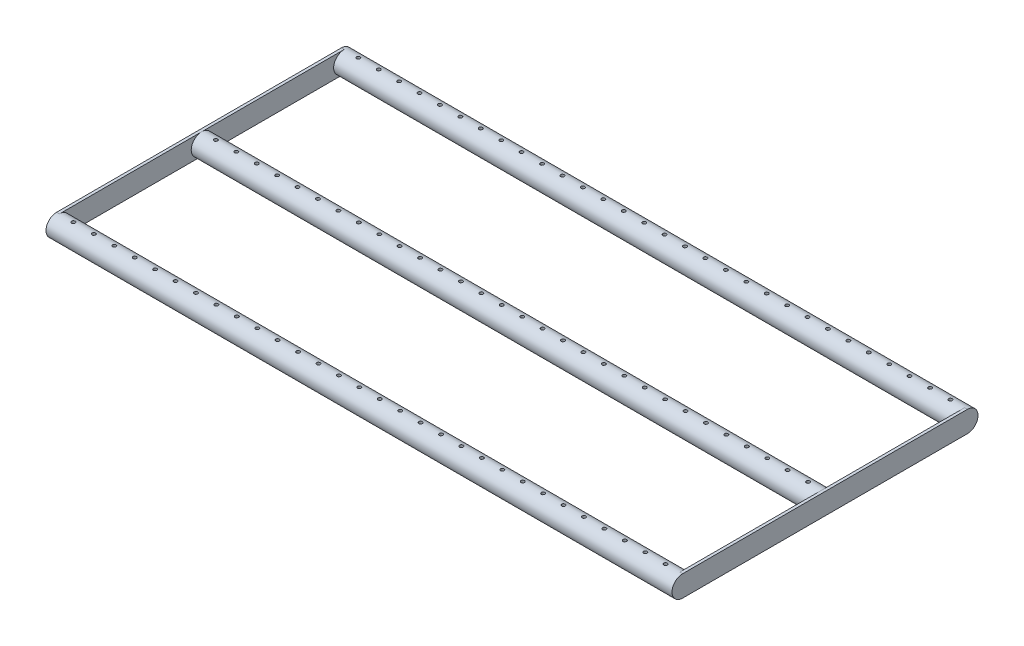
SolidWorks part; units mm, degrees
ref_plane "Front Plane" through (0, 0, 0) normal (0, 0, 1) x (1, 0, 0)
ref_plane "Top Plane" through (0, 0, 0) normal (0, 1, 0) x (1, 0, 0)
ref_plane "Right Plane" through (0, 0, 0) normal (1, 0, 0) x (0, 0, -1)
sketch "Sketch4" plane through (0, 0, 0) normal (0, 1, 0) x (1, 0, 0)
  line L1 (279.4, -204.47) -> (-279.4, -204.47) construction
  line L2 (279.4, -204.47) -> (279.4, 204.47) construction
  line L3 (279.4, 204.47) -> (-279.4, 204.47) construction
  line L4 (-279.4, -204.47) -> (-279.4, 204.47) construction
  line L5 (279.4, -204.47) -> (-279.4, 204.47) construction
  line L6 (279.4, 204.47) -> (-279.4, -204.47) construction
  point P0 (0, 0)
  dimension "D1" = 558.8
  dimension "D2" = 408.94
sketch "Sketch5" plane through (0, 0, 0) normal (1, 0, 0) x (0, 0, -1)
  line L0 (204.47, 0) -> (-204.47, 0) construction
  line L1 (-128.27, 0) -> (128.27, 0) construction
  line L2 (-204.47, 0) -> (204.47, 0) construction
  circle A0 centre (-128.27, 0) radius 9.525
  circle A1 centre (-128.27, 0) radius 6.985
  point P8 (-204.47, 0)
  dimension "D2" = 2.54
  dimension "D3" = 19.05
  dimension "D1" = 76.2
extrude "Extrude4" add sketch "Sketch5" along normal up to vertex and the other way up to vertex
sketch "Sketch6" plane through (0, 0, 0) normal (1, 0, 0) x (0, 0, -1)
  line L0 (-128.27, 0) -> (128.27, 0) construction
  line L1 (-128.27, 0) -> (128.27, 0)
sketch "Sketch9" plane through (0, 0, 0) normal (0, 1, 0) x (1, 0, 0)
  line L0 (-266.7, -128.27) -> (266.7, -128.27) construction
  line L3 (0, -118.745) -> (0, -137.795) construction
  line L4 (279.4, -118.745) -> (-279.4, -118.745) construction
  line L5 (-279.4, -137.795) -> (279.4, -137.795) construction
  line L6 (279.4, -204.47) -> (279.4, 204.47) construction
  point P9 (0, -128.27)
  dimension "D1" = 12.7
sketch "Sketch10" plane through (0, 0, 0) normal (0, 1, 0) x (1, 0, 0)
  circle A0 centre (266.7, -128.27) radius 1.5875
  dimension "D1" = 3.175
extrude "Extrude7" cut sketch "Sketch10" along normal through all
pattern_curve "CrvPattern3" of "Extrude7" parameters "D1"=30, "D3"=50, "D2"=1, "D4"=50
pattern_curve "CrvPattern1" parameters "D1"=3, "D3"=50, "D2"=1, "D4"=50
sketch "Sketch7" plane through (279.4, 0, 0) normal (1, 0, 0) x (0, 0, -1)
  line L0 (-128.27, 9.525) -> (128.27, 9.525)
  line L1 (128.27, -9.525) -> (-128.27, -9.525)
  arc A3 (-128.27, 9.525) -> (-128.27, -9.525) centre (-128.27, 0) ccw
  arc A4 (128.27, -9.525) -> (128.27, 9.525) centre (128.27, 0) ccw
  dimension "D1" = 19.05
extrude "Extrude5" add sketch "Sketch7" along normal blind 2.54
mirror "Mirror2" about plane through (0, 0, 0) normal (1, 0, 0) of "Extrude5"
